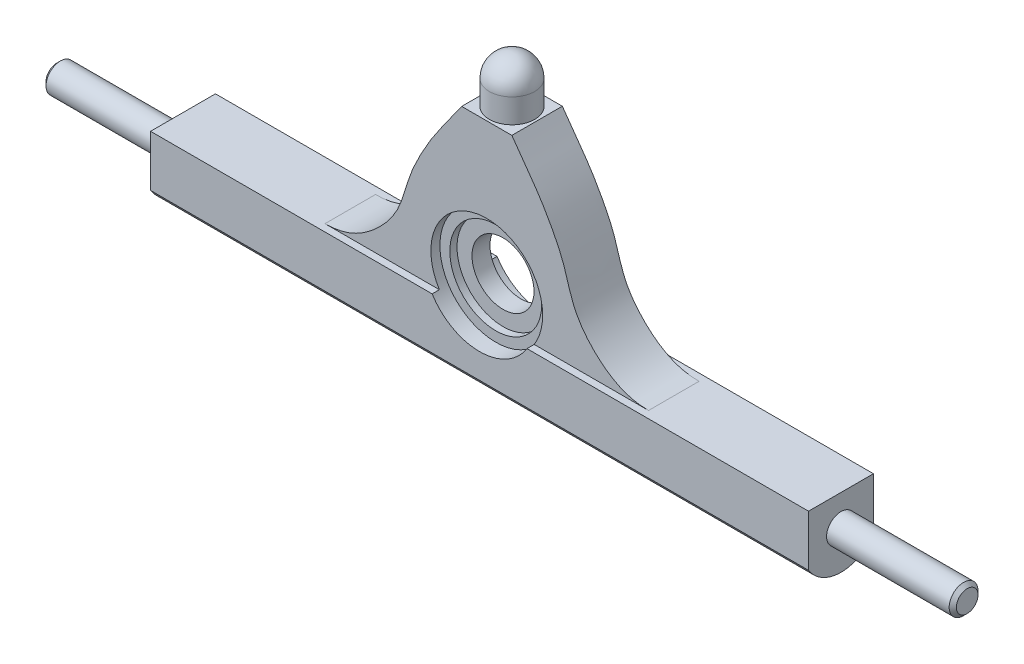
SolidWorks part; units mm, degrees
ref_plane "Plan de face" through (0, 0, 0) normal (0, 0, 1) x (1, 0, 0)
ref_plane "Plan de dessus" through (0, 0, 0) normal (0, 1, 0) x (1, 0, 0)
ref_plane "Plan de droite" through (0, 0, 0) normal (1, 0, 0) x (0, 0, -1)
sketch "Esquisse1" plane through (0, 0, 0) normal (0, 0, 1) x (1, 0, 0)
  line L0 (0, 0) -> (0, 15.8763) construction
  line L1 (0, 0) -> (126.25, 0) construction
  line L2 (-126.25, 4) -> (126.25, 4)
  line L3 (126.25, 4) -> (126.25, 0)
  line L4 (-126.25, 4) -> (-126.25, 0)
  line L5 (126.25, 0) -> (-126.25, 0)
  point P3 (63.125, 0)
  point P8 (0, 4)
  point P9 (0, 0)
  dimension "D1" = 8
  dimension "D2" = 252.5
revolve "Révolution1" add sketch "Esquisse1" angle 360 about L5
sketch "Esquisse3" plane through (0, 0, 0) normal (1, 0, 0) x (0, 0, -1)
  line L0 (0, 0) -> (0, 12.1904) construction
  line L1 (9, 8.6) -> (-9, 8.6)
  line L2 (-9, 8.6) -> (-9, -5.6)
  line L3 (0, -10.6) -> (8.432, -10.6) construction
  line L4 (9, 8.6) -> (9, -5.6)
  arc A0 (9, -5.6) -> (-9, -5.6) centre (0, 0) cw
  point P11 (0, 8.6)
  dimension "D1" = 18
  dimension "D2" = 8.6
  dimension "D3" = 19.2
  dimension "D4" = 5
extrude "Boss.-Extru.1" add sketch "Esquisse3" along normal mid plane 182.5
sketch "Esquisse6"
sketch "Esquisse5" plane through (0, 0, 0) normal (0, 0, 1) x (1, 0, 0)
  line L0 (0, 0) -> (0, 65.961) construction
  line L1 (91.25, 8.6) -> (-91.25, 8.6) construction
  line L2 (-6.9591, 55.7253) -> (6.9591, 55.7253)
  line L3 (44.8718, 8.6) -> (-44.8718, 8.6)
  line L4 (-42.8696, 8.6) -> (-46.8741, 8.6) construction
  spline S0 degree 3 poles (-44.8718, 8.6) (-42.369, 8.6) (-36.9569, 9.5751) (-29.6946, 14.7882) (-23.5797, 22.7426) (-22.0039, 30.8319) (-18.66, 38.0648) (-14.2518, 45.9423) (-9.561, 51.9184) (-6.9591, 55.7253) knots 0 0 0 0 0.111429 0.262064 0.406674 0.57518 0.642677 0.782298 1 1 1 1
  spline S1 degree 3 poles (44.8718, 8.6) (42.369, 8.6) (36.9569, 9.5751) (29.6946, 14.7882) (23.5797, 22.7426) (22.0039, 30.8319) (18.66, 38.0648) (14.2518, 45.9423) (9.561, 51.9184) (6.9591, 55.7253) knots 0 0 0 0 0.111429 0.262064 0.406674 0.57518 0.642677 0.782298 1 1 1 1
  point P23 (0, 0)
  point P24 (0, 0)
  point P25 (0, 0)
extrude "Boss.-Extru.2" add sketch "Esquisse5" along normal mid plane 14
sketch "Esquisse7" plane through (0, 0, 9) normal (0, 0, 1) x (1, 0, 0)
  line L0 (0, 55.7253) -> (0, 0) construction
  line L1 (6.9591, 55.7253) -> (-6.9591, 55.7253) construction
  line L2 (-91.25, -10.6) -> (91.25, -10.6) construction
  circle A0 centre (0, 16.8) radius 8.6
  dimension "D1" = 17.2
  dimension "D2" = 27.4
extrude "Enlèv. mat.-Extru.1" cut sketch "Esquisse7" against normal through all
sketch "Esquisse8" plane through (0, 0, 9) normal (0, 0, 1) x (1, 0, 0)
  circle A0 centre (0, 16.8) radius 15.5
  dimension "D1" = 31
extrude "Enlèv. mat.-Extru.2" cut sketch "Esquisse8" against normal blind 4.5
sketch "Esquisse9" plane through (0, 0, 4.5) normal (0, 0, 1) x (1, 0, 0)
  circle A0 centre (0, 16.8) radius 12.75
  dimension "D1" = 25.5
extrude "Enlèv. mat.-Extru.3" cut sketch "Esquisse9" against normal blind 2
mirror "Symétrie1" about plane through (0, 0, 0) normal (0, 0, 1) of "Enlèv. mat.-Extru.3", "Enlèv. mat.-Extru.2"
sketch "Esquisse10" plane through (0, 0, 0) normal (0, 0, 1) x (1, 0, 0)
  line L0 (0, 55.7253) -> (0, 79.6367) construction
  line L1 (6.9591, 55.7253) -> (-6.9591, 55.7253) construction
  line L2 (0, 55.7253) -> (-6.3, 55.7253)
  line L3 (-6.3, 55.7253) -> (-6.3, 62.4253)
  line L4 (0, 68.7253) -> (0, 55.7253)
  arc A0 (-6.3, 62.4253) -> (0, 68.7253) centre (0, 62.4253) cw
  dimension "D1" = 12.6
  dimension "D2" = 13
revolve "Révolution2" add sketch "Esquisse10" angle 360 about L4
chamfer "Chanfrein1" distance 1 angle 45 2 edges at (-126.25, 0, -4) (126.25, 0, -4)
